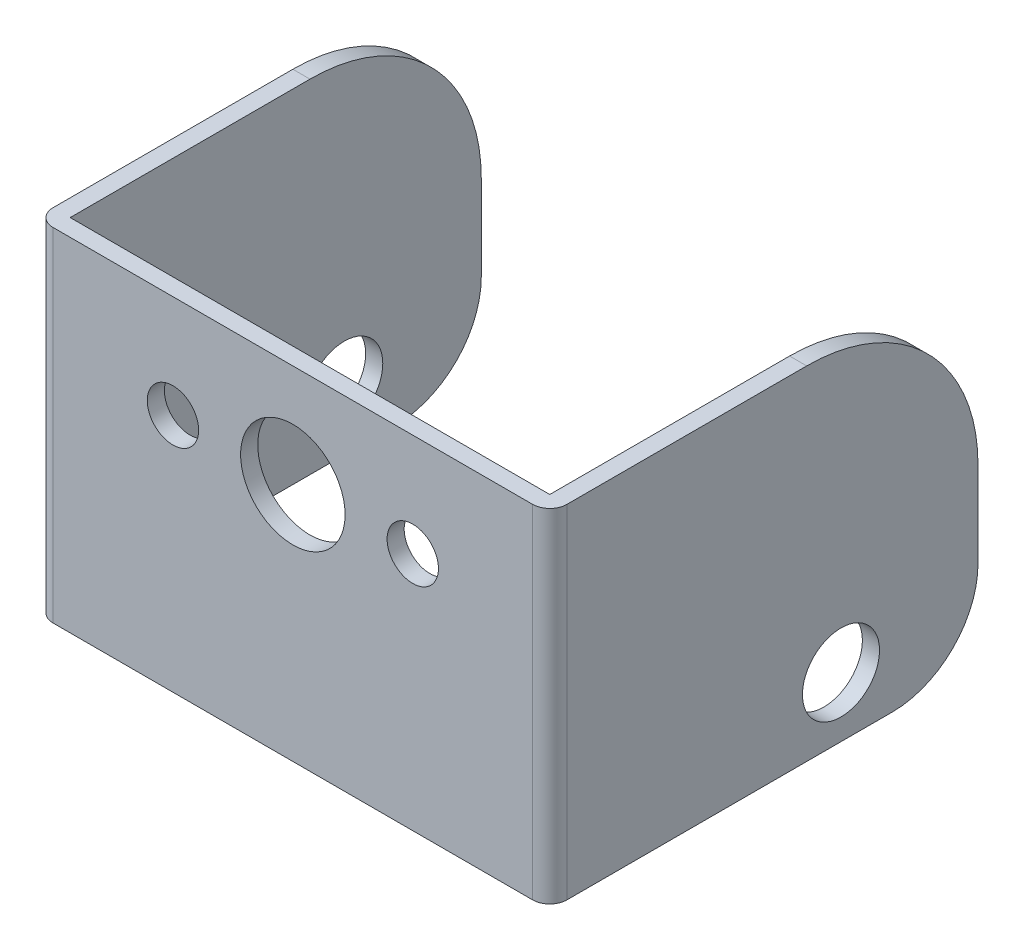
SolidWorks part; units mm, degrees
ref_plane "Front Plane" through (0, 0, 0) normal (0, 0, 1) x (1, 0, 0)
ref_plane "Top Plane" through (0, 0, 0) normal (0, 1, 0) x (1, 0, 0)
ref_plane "Right Plane" through (0, 0, 0) normal (1, 0, 0) x (0, 0, -1)
sketch "Sketch1" plane through (0, 0, 0) normal (0, 1, 0) x (1, 0, 0)
  line L0 (0, 0) -> (30, 0)
  line L1 (30, 0) -> (30, 25)
  line L2 (30, 25) -> (29, 25)
  line L3 (29, 25) -> (29, 1)
  line L4 (29, 1) -> (1, 1)
  line L5 (1, 1) -> (1, 25)
  line L6 (1, 25) -> (0, 25)
  line L7 (0, 25) -> (0, 0)
  dimension "D1" = 1
  dimension "D2" = 1
  dimension "D3" = 1
  dimension "D4" = 30
  dimension "D5" = 25
  dimension "D6" = 25
extrude "Extrude1" add sketch "Sketch1" along normal blind 20
sketch "Sketch2" plane through (0, 0, 0) normal (0, 0, 1) x (1, 0, 0)
  line L0 (22, 14) -> (8, 14) construction
  line L2 (0, 0) -> (30, 0) construction
  line L3 (15, 20) -> (15, 0) construction
  line L4 (0, 20) -> (30, 20) construction
  circle A0 centre (15, 14) radius 3.05
  circle A1 centre (15, 14) radius 7 construction
  circle A2 centre (22, 14) radius 1.5
  circle A3 centre (8, 14) radius 1.5
  dimension "D1" = 6.1
  dimension "D2" = 3
  dimension "D4" = 14
  dimension "D3" = 14
extrude "Extrude2" cut sketch "Sketch2" against normal blind 25
sketch "Sketch3" plane through (30, 0, 0) normal (1, 0, 0) x (0, 0, -1)
  line L0 (0, 0) -> (25, 0) construction
  line L2 (0, 20) -> (0, 0) construction
  circle A0 centre (17, 3.5) radius 2.25
  dimension "D1" = 4.5
  dimension "D2" = 3.5
  dimension "D3" = 17
extrude "Extrude3" cut sketch "Sketch3" against normal through all
fillet "Fillet1" radius 1 2 edges at (30, 10, 0) (0, 10, 0)
fillet "Fillet2" radius 10 2 edges at (29.5, 20, -25) (0.5, 20, -25)
fillet "Fillet3" radius 5 2 edges at (0.5, 0, -25) (29.5, 0, -25)
